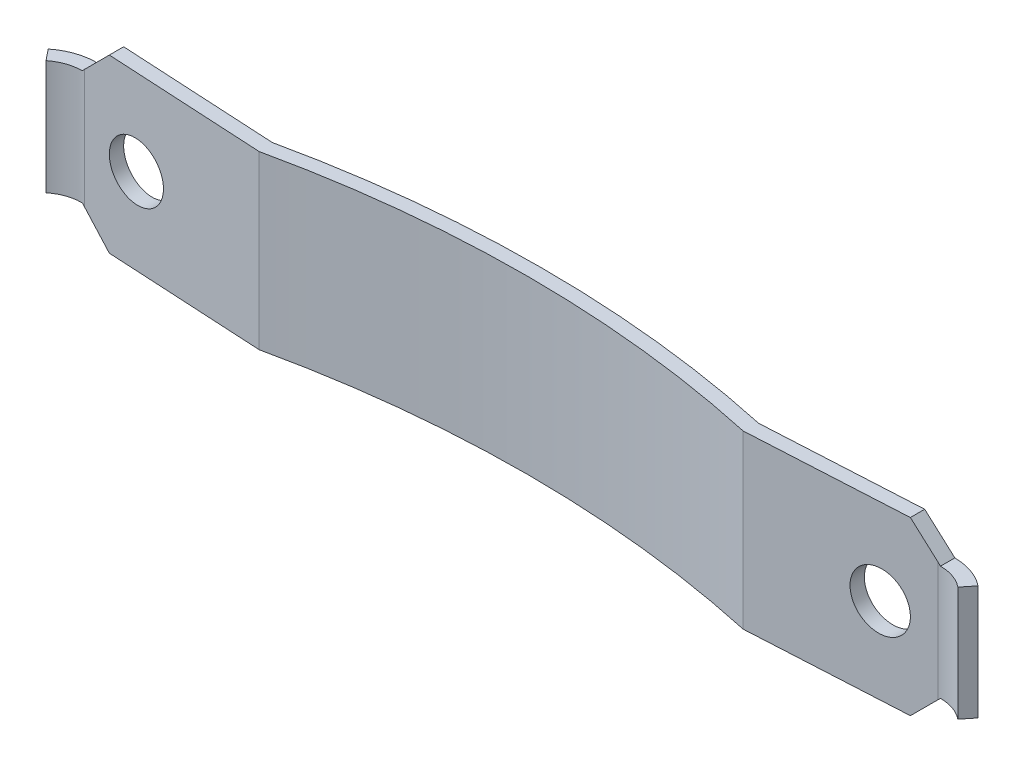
SolidWorks part; units mm, degrees
ref_plane "Plan de face" through (0, 0, 0) normal (0, 0, 1) x (1, 0, 0)
ref_plane "Plan de dessus" through (0, 0, 0) normal (0, 1, 0) x (1, 0, 0)
ref_plane "Plan de droite" through (0, 0, 0) normal (1, 0, 0) x (0, 0, -1)
sketch "Esquisse2" plane through (0, 0, 0) normal (0, 1, 0) x (1, 0, 0)
  line L2 (0, 0) -> (0, 1) construction
  line L3 (8.5, 0.0864) -> (14.8908, 0.4358)
  line L4 (0, 0) -> (20.6006, 0) construction
  arc A0 (8.5, 0.0864) -> (0, 1) centre (0, -39) ccw
  arc A1 (14.8908, 0.4358) -> (16.25, 0) centre (15, -1.5612) cw
  dimension "D3" = 80
  dimension "D4" = 2
  dimension "D1" = 16.25
  dimension "D2" = 1
  dimension "D5" = 15
  dimension "D6" = 8.5
extrude "Extru.-Mince1" add sketch "Esquisse2" along normal mid plane 6 thin
mirror "Symétrie1" about plane through (0, 0, 0) normal (1, 0, 0) of "Extru.-Mince1"
sketch "Esquisse3" plane through (0, 0, 0) normal (0, 0, 1) x (1, 0, 0)
  line L0 (-15, 2) -> (-14, 3)
  line L1 (-18.9012, 2) -> (-15, 2)
  line L2 (-18.9012, 2) -> (-18.9012, 3.7582)
  line L3 (-18.9012, 3.7582) -> (-14, 3.7582)
  line L4 (-14, 3) -> (-14, 3.7582)
  line L5 (0, 0) -> (-19.4547, 0) construction
  line L6 (-14, -3) -> (-14, -3.7582)
  line L7 (-18.9012, -3.7582) -> (-14, -3.7582)
  line L8 (-18.9012, -2) -> (-18.9012, -3.7582)
  line L9 (-18.9012, -2) -> (-15, -2)
  line L10 (-15, -2) -> (-14, -3)
  line L11 (0, 0) -> (0, 3.7582) construction
  line L12 (15, -2) -> (14, -3)
  line L13 (18.9012, -2) -> (15, -2)
  line L14 (18.9012, -2) -> (18.9012, -3.7582)
  line L15 (18.9012, -3.7582) -> (14, -3.7582)
  line L16 (14, -3) -> (14, -3.7582)
  line L17 (14, 3) -> (14, 3.7582)
  line L18 (18.9012, 3.7582) -> (14, 3.7582)
  line L19 (18.9012, 2) -> (18.9012, 3.7582)
  line L20 (18.9012, 2) -> (15, 2)
  line L21 (15, 2) -> (14, 3)
  circle A0 centre (-13, 0) radius 1
  circle A1 centre (13, 0) radius 1
  point P3 (-14, 2)
  point P9 (-14, -2)
  point P15 (14, -2)
  point P17 (14, 2)
  dimension "D4" = 2
  dimension "D3" = 1
  dimension "D1" = 2
  dimension "D2" = 14
  dimension "D5" = 13
extrude "Enlèv. mat.-Extru.1" cut sketch "Esquisse3" against normal mid plane 6
